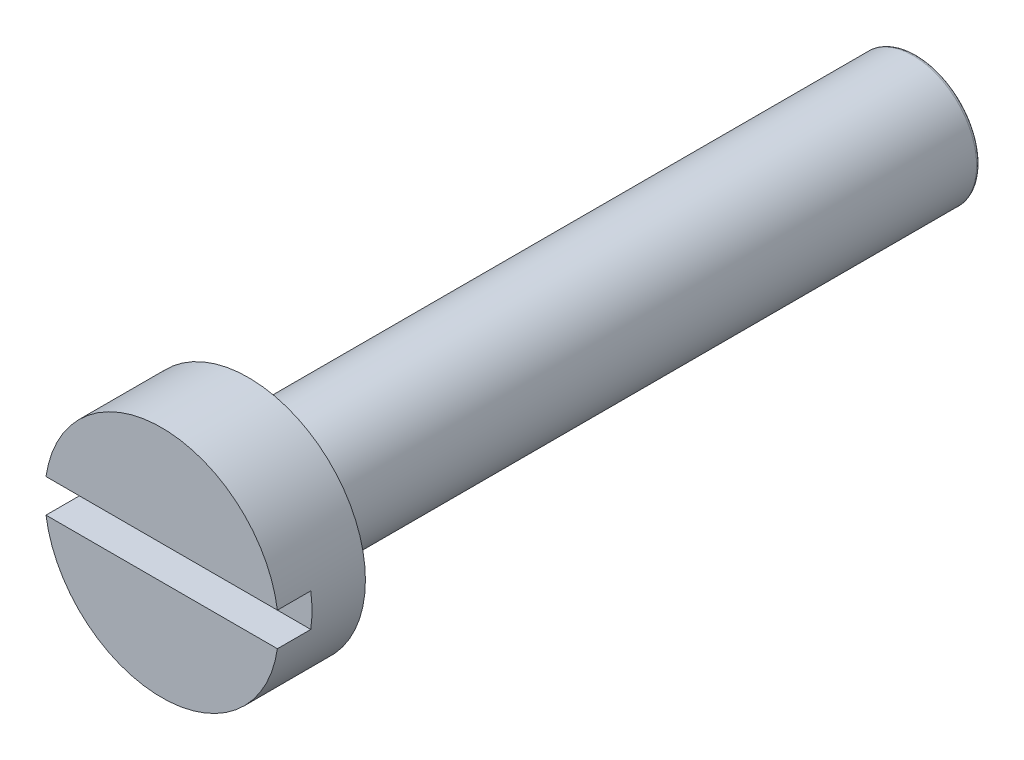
SolidWorks part; units mm, degrees
ref_plane "Plan de face" through (0, 0, 0) normal (0, 0, 1) x (1, 0, 0)
ref_plane "Plan de dessus" through (0, 0, 0) normal (0, 1, 0) x (1, 0, 0)
ref_plane "Plan de droite" through (0, 0, 0) normal (1, 0, 0) x (0, 0, -1)
sketch "Esquisse1" plane through (0, 0, 0) normal (0, 0, 1) x (1, 0, 0)
  circle A0 centre (0, 0) radius 3.5
extrude "Extrusion1" add sketch "Esquisse1" along normal blind 2.6
sketch "Esquisse2" plane through (0, 0, 2.6) normal (0, 0, 1) x (1, 0, 0)
  line L1 (-10, 0.5) -> (10, 0.5) construction
  line L2 (-10, -0.5) -> (10, -0.5) construction
  line L3 (-10, 0.5) -> (10, 0.5)
  line L4 (-10, 0.5) -> (-10, -0.5)
  line L5 (-10, -0.5) -> (10, -0.5)
  line L6 (10, 0.5) -> (10, -0.5)
extrude "Enlèv. mat.-Extru.1" cut sketch "Esquisse2" against normal blind 1
sketch "Esquisse3" plane through (0, 0, 0) normal (0, 0, -1) x (-1, 0, 0)
  circle A0 centre (0, 0) radius 1.9
extrude "Extrusion2" add sketch "Esquisse3" along normal blind 20
fillet "Congé1" radius 0.1 1 edges at (-1.9, 0, -20)
